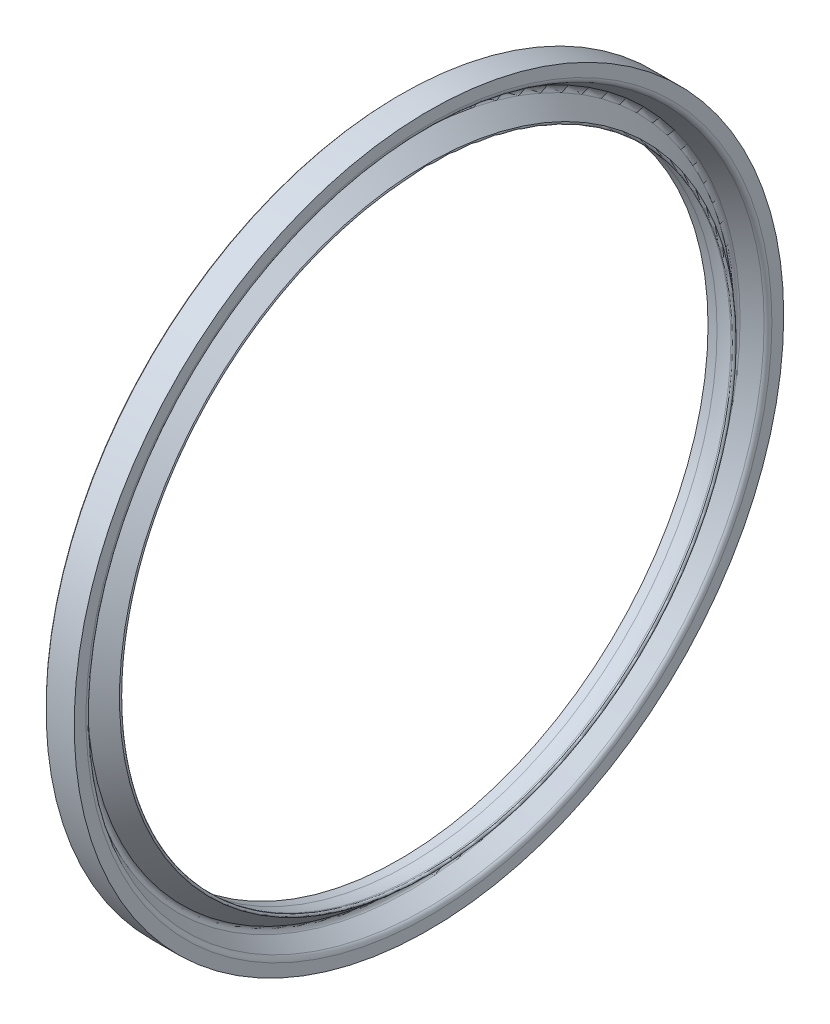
SolidWorks part; units mm, degrees
ref_plane "Plan1" through (0, 0, 0) normal (0, 0, 1) x (1, 0, 0)
ref_plane "Plan2" through (0, 0, 0) normal (0, 1, 0) x (1, 0, 0)
ref_plane "Plan3" through (0, 0, 0) normal (1, 0, 0) x (0, 0, -1)
sketch "Esquisse1" plane through (0, 0, 0) normal (0, 0, 1) x (-1, 0, 0)
  line L0 (4.6, 58) -> (4.8, 57.8)
  line L3 (0, 58) -> (4.6, 58)
  line L4 (0, 58) -> (0, 56.0659)
  line L5 (0.4671, 55.2568) -> (2.9548, 53.8206)
  line L6 (4.8, 57.8) -> (4.8, 50.4287)
  line L7 (3.0435, 52.8063) -> (0.1869, 50.4093)
  line L8 (0, 0) -> (0, 58) construction
  line L9 (-2.434, 0) -> (3.3798, 0) construction
  line L10 (4.8, 50.4287) -> (3.3299, 50.4287)
  line L11 (0.7154, 50.0845) -> (0.4, 50)
  arc A0 (3.3299, 50.4287) -> (0.7154, 50.0845) centre (3.3299, 40.3273) ccw
  arc A1 (2.9548, 53.8206) -> (3.0435, 52.8063) centre (2.644, 53.2824) cw
  arc A2 (0.4671, 55.2568) -> (0, 56.0659) centre (0.9343, 56.0659) cw
  arc A4 (0.1869, 50.4093) -> (0.4, 50) centre (0.3388, 50.2283) ccw
  point P10 (2, 50.4287)
  point P20 (1.8977, 51.685)
  point P24 (0, 52.7807)
  dimension "D5" = 120
  dimension "D8" = 1.685
  dimension "D3" = 0.4
  dimension "D1" = 45
  dimension "Diamètre extérieur" = 58
  dimension "D2" = 0.2
  dimension "Epaisseur" = 4.8
  dimension "D4" = 70
  dimension "D7" = 2
  dimension "Diamètre nominal" = 50
revolve "Base-Révolution" add sketch "Esquisse1" angle 360 about L9
